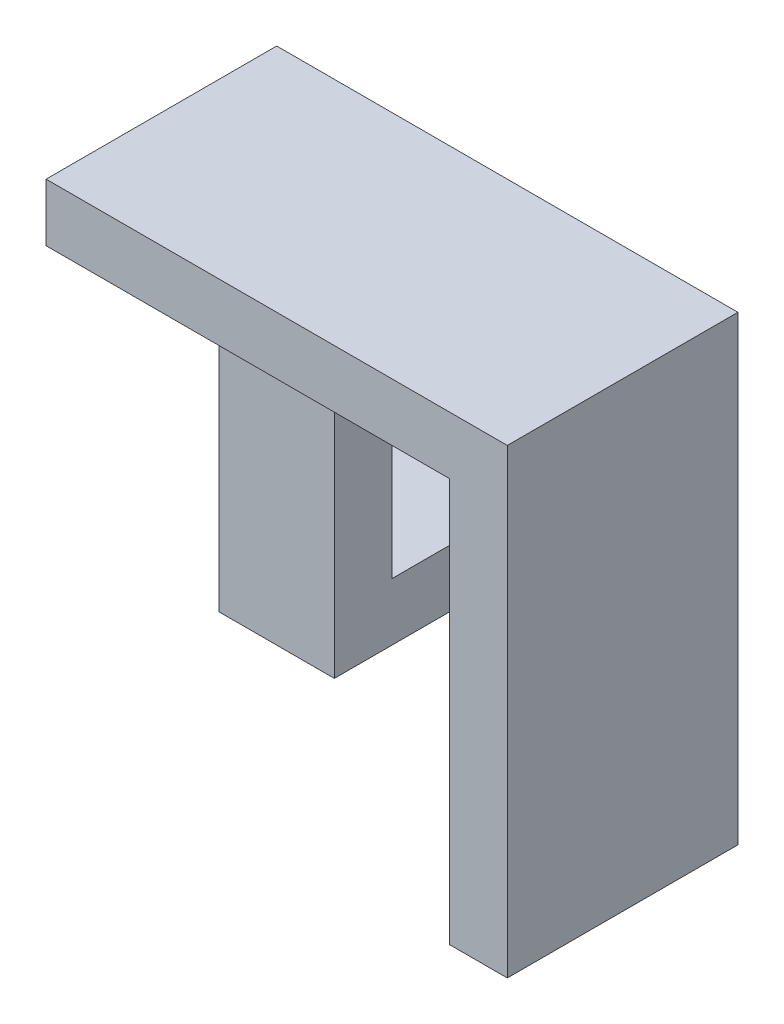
SolidWorks part; units mm, degrees
ref_plane "Alzado" through (0, 0, 0) normal (0, 0, 1) x (1, 0, 0)
ref_plane "Planta" through (0, 0, 0) normal (0, 1, 0) x (1, 0, 0)
ref_plane "Vista lateral" through (0, 0, 0) normal (1, 0, 0) x (0, 0, -1)
sketch "Croquis1" plane through (0, 0, 0) normal (0, 0, 1) x (1, 0, 0)
  line L0 (40, 40) -> (-40, -40) construction
  line L1 (-40, 40) -> (40, 40)
  line L2 (-40, 40) -> (-40, -40)
  line L3 (-40, -40) -> (40, -40)
  line L4 (40, 40) -> (40, -40)
  line L5 (40, -40) -> (-40, 40) construction
  dimension "D1" = 80
  dimension "D2" = 80
extrude "Saliente-Extruir1" add sketch "Croquis1" along normal mid plane 70
sketch "Croquis15" plane through (0, 0, 0) normal (0, 0, 1) x (1, 0, 0)
  line L0 (-40, -40) -> (40, -40) construction
  line L1 (-20, 30) -> (30, 30)
  line L2 (-20, 30) -> (-20, -40)
  line L3 (-20, -40) -> (30, -40)
  line L4 (30, 30) -> (30, -40)
  line L5 (40, 40) -> (-40, 40) construction
  line L6 (-40, 40) -> (-40, -40) construction
  line L7 (40, -40) -> (40, 40) construction
  dimension "D1" = 10
  dimension "D2" = 20
  dimension "D3" = 10
extrude "Cortar-Extruir13" cut sketch "Croquis15" against normal through all and the other way through all
sketch "Croquis16" plane through (-40, 0, 0) normal (-1, 0, 0) x (0, 0, 1)
  line L0 (35, 40) -> (-35, 40) construction
  line L1 (35, -40) -> (5, -40)
  line L2 (35, -40) -> (35, 30)
  line L3 (35, 30) -> (5, 30)
  line L4 (5, -40) -> (5, 30)
  dimension "D1" = 10
  dimension "D2" = 30
extrude "Cortar-Extruir14" cut sketch "Croquis16" against normal up to surface (70 mm away)
sketch "Croquis17" plane through (-40, 0, 0) normal (-1, 0, 0) x (0, 0, 1)
  line L0 (5, -40) -> (-35, -40) construction
  line L1 (-35, 40) -> (-5, 40)
  line L2 (-35, 40) -> (-35, -30)
  line L3 (-35, -30) -> (-5, -30)
  line L4 (-5, 40) -> (-5, -30)
  dimension "D1" = 10
  dimension "D2" = 30
extrude "Cortar-Extruir15" cut sketch "Croquis17" against normal through all
sketch "Croquis18" plane through (0, -30, 0) normal (0, 1, 0) x (1, 0, 0)
  line L4 (30, 5) -> (40, 5)
  line L5 (40, 5) -> (40, 35)
  line L6 (40, 35) -> (30, 35)
  line L7 (30, 35) -> (30, 5)
  line L8 (30, 5) -> (40, 5)
  line L9 (40, 5) -> (40, 35)
  line L10 (40, 35) -> (30, 35)
  line L11 (30, 35) -> (30, 5)
  dimension "D1" = 0
extrude "Cortar-Extruir16" cut sketch "Croquis18" against normal through all
